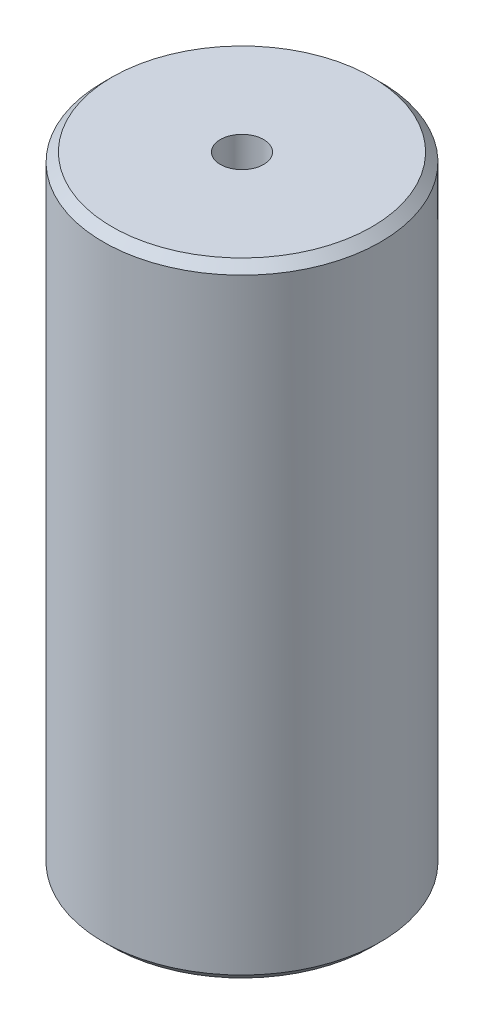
SolidWorks part; units mm, degrees
ref_plane "Front Plane" through (0, 0, 0) normal (0, 0, 1) x (1, 0, 0)
ref_plane "Top Plane" through (0, 0, 0) normal (0, 1, 0) x (1, 0, 0)
ref_plane "Right Plane" through (0, 0, 0) normal (1, 0, 0) x (0, 0, -1)
sketch "Sketch1" plane through (0, 0, 0) normal (0, 0, 1) x (1, 0, 0)
  line L0 (0, 114.3) -> (0, 0) construction
  line L2 (0, 0) -> (25.4, 0)
  line L3 (0, 0) -> (0, 114.3)
  line L4 (0, 114.3) -> (25.4, 114.3)
  line L5 (25.4, 0) -> (25.4, 114.3)
  dimension "D" = 50.8
  dimension "L" = 114.3
revolve "Revolve1" add sketch "Sketch1" angle 360 about L0
chamfer "Chamfer1" distance 1.6002 angle 45 2 edges at (-25.4, 0, 0) (-25.4, 114.3, 0)
hole_wizard "3/8-16 Tapped Hole1" positions "Sketch3" profile "Sketch2" tap size "3/8-16" standard "ANSI Inch"
sketch "Sketch3" plane through (0, 0, 0) normal (0, -1, 0) x (-1, 0, 0)
  point P0 (0, 0)
sketch "Sketch2" plane through (0, 0, 0) normal (1, 0, 0) x (0, 0, -1)
  line L0 (0, 0) -> (0, 23.0222)
  line L1 (0, 23.0222) -> (3.9687, 20.6375)
  line L2 (3.9687, 20.6375) -> (3.9687, 0)
  line L5 (3.9687, 0) -> (0, 0)
  line L10 (0, 23.0222) -> (-3.9688, 20.6375) construction
  line L11 (0, -6.35) -> (0, 107.95) construction
  dimension "Tap Drill Dia." = 7.9375
  dimension "Tap Drill Depth" = 20.6375
  dimension "Drill Angle" = 118
ref_plane "Plane1" through (0, 57.15, 0) normal (0, 1, 0) x (1, 0, 0)
hole_wizard "5/8-11 Tapped Hole1" positions "Sketch5" profile "Sketch4" tap size "5/8-11" standard "ANSI Inch"
sketch "Sketch5" plane through (0, 0, 0) normal (0, -1, 0) x (-1, 0, 0)
  point P0 (0, 0)
sketch "Sketch4" plane through (0, 0, 0) normal (1, 0, 0) x (0, 0, -1)
  line L0 (0, 0) -> (0, 42.7377)
  line L1 (0, 42.7377) -> (6.7462, 38.6842)
  line L2 (6.7462, 38.6842) -> (6.7462, 0)
  line L5 (6.7462, 0) -> (0, 0)
  line L10 (0, 42.7377) -> (-6.7462, 38.6842) construction
  line L11 (0, -6.35) -> (0, 107.95) construction
  dimension "Tap Drill Dia." = 13.4925
  dimension "Tap Drill Depth" = 38.6842
  dimension "Drill Angle" = 118
mirror "Mirror1" [suppressed] about plane through (0, 57.15, 0) normal (0, 1, 0)
mirror "Mirror2" about plane through (0, 57.15, 0) normal (0, 1, 0) of "3/8-16 Tapped Hole1"
